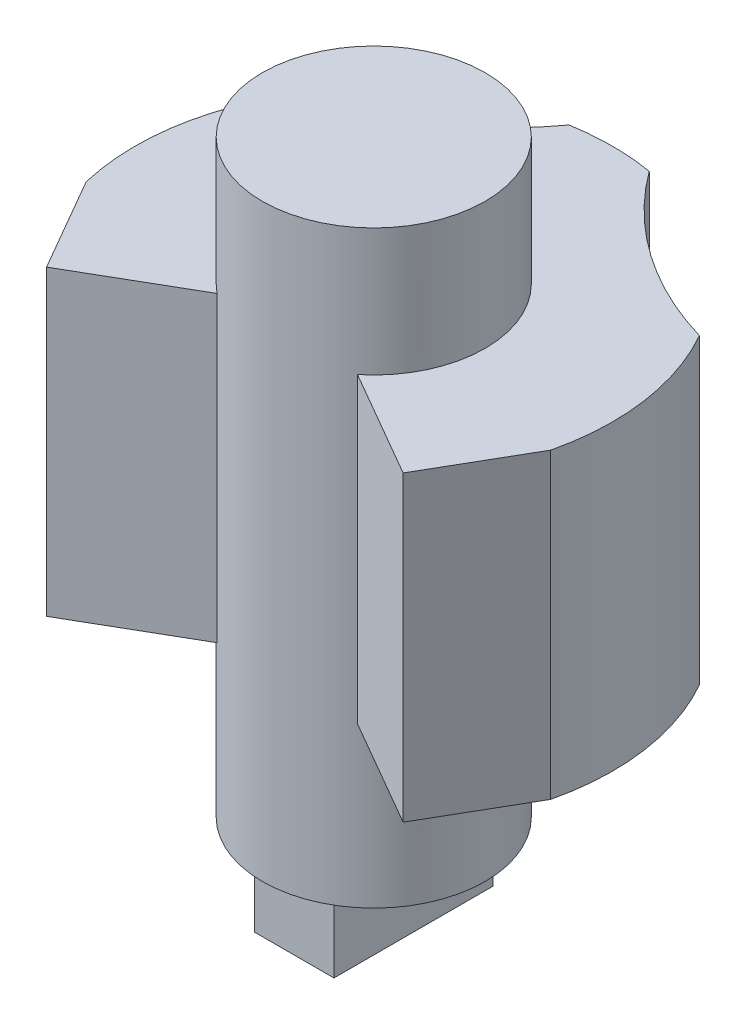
SolidWorks part; units mm, degrees
ref_plane "FRONT" through (0, 0, 0) normal (0, 0, 1) x (1, 0, 0)
ref_plane "TOP" through (0, 0, 0) normal (0, 1, 0) x (1, 0, 0)
ref_plane "RIGHT" through (0, 0, 0) normal (1, 0, 0) x (0, 0, -1)
sketch "Sketch1" plane through (0, 0, 0) normal (0, 1, 0) x (1, 0, 0)
  line L0 (0, 0) -> (0, 61.3951) construction
  line L1 (0, 0) -> (42.1813, 60.2411) construction
  line L2 (0, 0) -> (75.3653, -43.5122) construction
  line L3 (2.8019, -3.4507) -> (7.1114, -5.9389)
  line L4 (7.1114, -5.9389) -> (9.2656, -2.2077)
  line L5 (0, 9.525) -> (0, -4.445)
  arc A0 (0, 9.525) -> (1.5997, 9.3897) centre (0, 0) cw
  arc A1 (8.2763, 4.7147) -> (1.5997, 9.3897) centre (11.8372, 16.9053) cw
  arc A2 (8.2763, 4.7147) -> (9.2656, -2.2077) centre (0, 0) cw
  arc A3 (0, -4.445) -> (2.8019, -3.4507) centre (0, 0) ccw
  dimension "D1" = 9.525
  dimension "D2" = 9.1281
  dimension "D6" = 4.445
  dimension "D8" = 12.7
  dimension "D3" = 1.5875
  dimension "D4" = 35
  dimension "D5" = 85
  dimension "D7" = 20.6375
extrude "Base-Extrude" add sketch "Sketch1" along normal blind 12.065
mirror "Boss-Mirror1" about plane through (0, 12.065, -9.525) normal (1, 0, 0)
sketch "Sketch2" plane through (0, 12.065, 0) normal (0, 1, 0) x (-1, 0, 0)
  circle A0 centre (0, 0) radius 4.445
  arc A1 (2.8019, 3.4507) -> (-2.8019, 3.4507) centre (0, 0) ccw construction
extrude "Boss-Extrude1" add sketch "Sketch2" along normal blind 5.08
sketch "Sketch3" plane through (0, 0, 0) normal (0, -1, 0) x (1, 0, 0)
  circle A0 centre (0, 0) radius 4.445
  arc A1 (2.8019, 3.4507) -> (-2.8019, 3.4507) centre (0, 0) ccw construction
extrude "Boss-Extrude2" add sketch "Sketch3" along normal blind 6.35
sketch "Sketch5" plane through (0, -6.35, 0) normal (0, -1, 0) x (1, 0, 0)
  line L0 (-1.5875, 3.175) -> (1.5875, 3.175)
  line L1 (-1.5875, 3.175) -> (-1.5875, -3.175)
  line L2 (1.5875, -3.175) -> (-1.5875, -3.175)
  line L3 (1.5875, -3.175) -> (1.5875, 3.175)
  line L4 (50, 0) -> (-50, 0) construction
  line L5 (0, -50) -> (0, 50) construction
  dimension "D1" = 6.35
  dimension "D2" = 3.175
  dimension "D3" = 3.175
  dimension "D4" = 1.5875
extrude "Boss-Extrude3" add sketch "Sketch5" along normal blind 3.175
